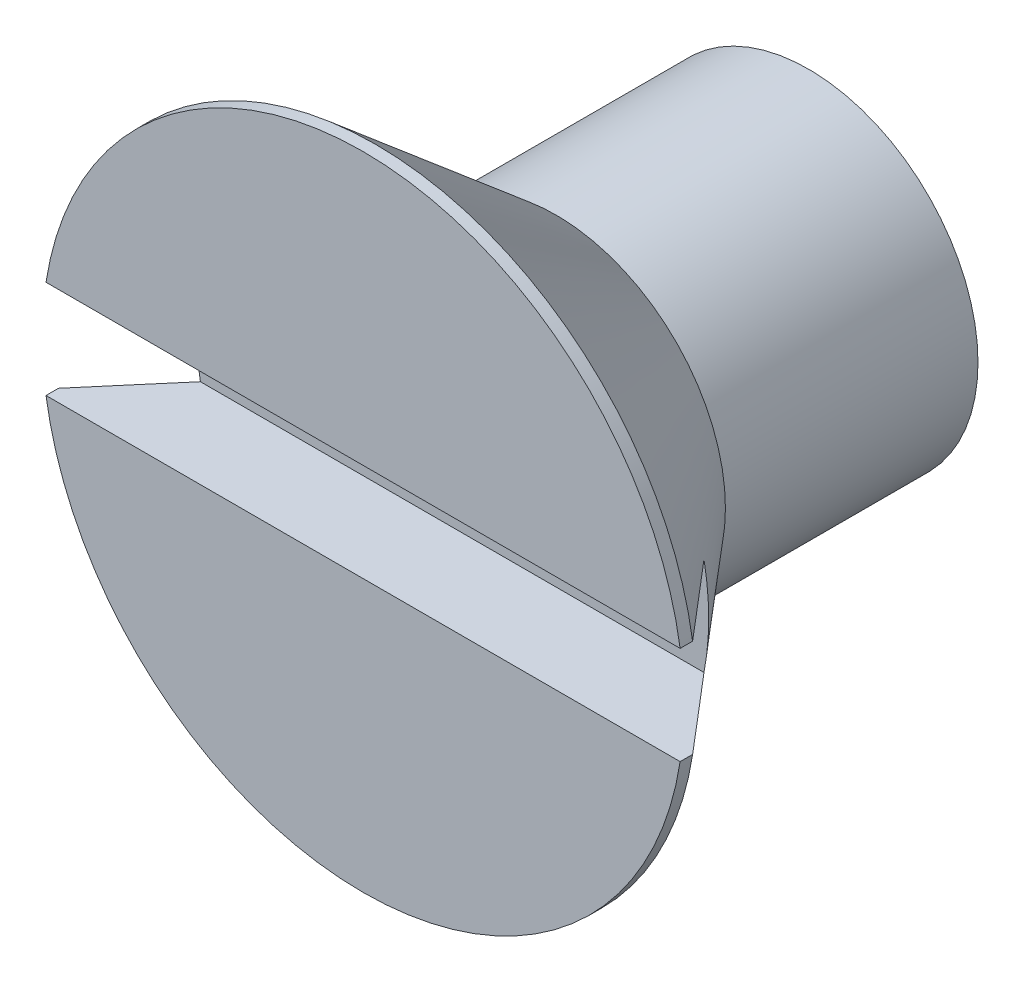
SolidWorks part; units mm, degrees
ref_plane "Спереди" through (0, 0, 0) normal (0, 0, 1) x (1, 0, 0)
ref_plane "Сверху" through (0, 0, 0) normal (0, 1, 0) x (1, 0, 0)
ref_plane "Справа" through (0, 0, 0) normal (1, 0, 0) x (0, 0, -1)
sketch "Эскиз1" plane through (0, 0, 0) normal (1, 0, 0) x (0, 0, -1)
  line L0 (0, 0) -> (0, 4.572)
  line L1 (0, 4.572) -> (0.1778, 4.572)
  line L2 (0.1778, 4.572) -> (2.7508, 2.413)
  line L3 (2.7508, 2.413) -> (5.113, 2.413)
  line L5 (5.113, 2.413) -> (6.35, 2.413)
  line L6 (6.35, 2.413) -> (6.35, 0)
  line L7 (6.35, 0) -> (0, 0)
  line L8 (-12.9734, 0) -> (43.4991, 0) construction
  dimension "D1" = 9.144
  dimension "D2" = 40
  dimension "D3" = 4.826
  dimension "D4" = 0.1778
  dimension "D5" = 6.35
revolve "Повернуть1" add sketch "Эскиз1" angle 360 about L8
sketch "Эскиз2" plane through (0, 0, 0) normal (1, 0, 0) x (0, 0, -1)
  line L1 (1.27, 0.6985) -> (0, 0.6985)
  line L2 (1.27, 0.6985) -> (1.27, -0.6985)
  line L3 (1.27, -0.6985) -> (0, -0.6985)
  line L4 (0, 0.6985) -> (0, -0.6985)
  dimension "D1" = 1.397
  dimension "D2" = 1.27
extrude "Вырез-Вытянуть1" cut sketch "Эскиз2" against normal mid plane 10.16
